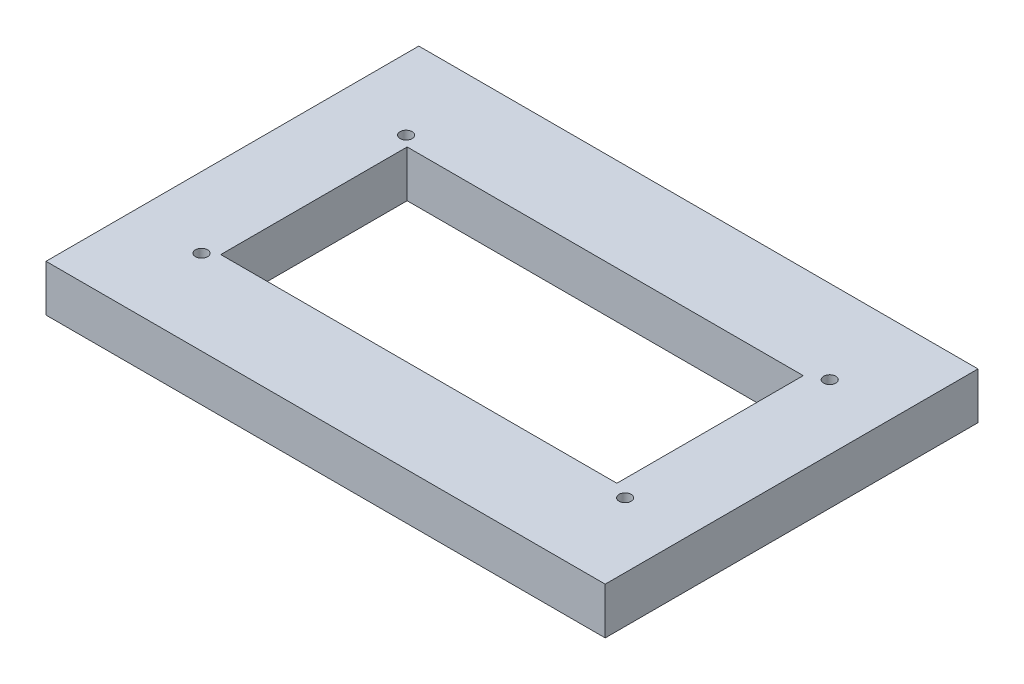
SolidWorks part; units mm, degrees
ref_plane "Front Plane" through (0, 0, 0) normal (0, 0, 1) x (1, 0, 0)
ref_plane "Top Plane" through (0, 0, 0) normal (0, 1, 0) x (1, 0, 0)
ref_plane "Right Plane" through (0, 0, 0) normal (1, 0, 0) x (0, 0, -1)
sketch "Sketch1" plane through (0, 0, 0) normal (0, 1, 0) x (1, 0, 0)
  line L1 (-152.4, 101.6) -> (152.4, 101.6)
  line L2 (-152.4, 101.6) -> (-152.4, -101.6)
  line L3 (-152.4, -101.6) -> (152.4, -101.6)
  line L4 (152.4, 101.6) -> (152.4, -101.6)
  line L5 (-152.4, 101.6) -> (152.4, -101.6) construction
  line L6 (-152.4, -101.6) -> (152.4, 101.6) construction
  point P0 (0, 0)
  dimension "D1" = 304.8
  dimension "D2" = 203.2
extrude "Boss-Extrude1" add sketch "Sketch1" along normal blind 25.4
sketch "Sketch2" plane through (0, 25.4, 0) normal (0, 1, 0) x (1, 0, 0)
  line L1 (-107.95, 50.8) -> (107.95, 50.8)
  line L2 (-107.95, 50.8) -> (-107.95, -50.8)
  line L3 (-107.95, -50.8) -> (107.95, -50.8)
  line L4 (107.95, 50.8) -> (107.95, -50.8)
  line L5 (-107.95, 50.8) -> (107.95, -50.8) construction
  line L6 (-107.95, -50.8) -> (107.95, 50.8) construction
  point P0 (0, 0)
  dimension "D1" = 215.9
  dimension "D2" = 101.6
extrude "Cut-Extrude1" cut sketch "Sketch2" against normal through all
sketch "Sketch3" plane through (0, 25.4, 0) normal (0, 1, 0) x (1, 0, 0)
  line L2 (0, 24.6953) -> (0, 0) construction
  line L3 (0, 0) -> (25.5529, 0) construction
  circle A0 centre (-113.8121, 56.1042) radius 3.3 construction
  circle A1 centre (-113.8121, -55.4093) radius 3.3 construction
  circle A2 centre (117.0718, -55.4093) radius 3.3 construction
  circle A3 centre (117.0718, 56.1042) radius 3.3 construction
  circle A4 centre (-113.8121, 56.1042) radius 3.3
  circle A5 centre (-113.8121, -55.4093) radius 3.3
  circle A6 centre (117.0718, -55.4093) radius 3.3
  circle A7 centre (117.0718, 56.1042) radius 3.3
extrude "Cut-Extrude2" cut sketch "Sketch3" against normal through all
